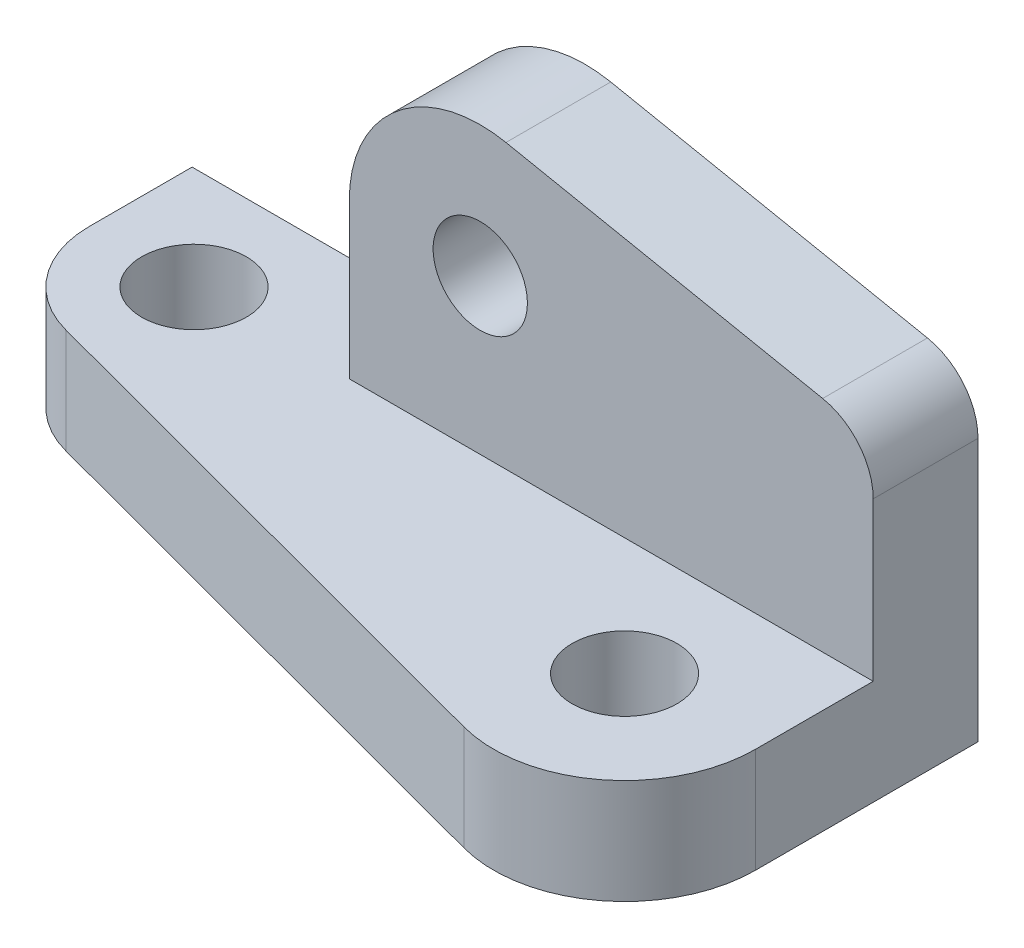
SolidWorks part; units mm, degrees
ref_plane "Front Plane" through (0, 0, 0) normal (0, 0, 1) x (1, 0, 0)
ref_plane "Top Plane" through (0, 0, 0) normal (0, 1, 0) x (1, 0, 0)
ref_plane "Right Plane" through (0, 0, 0) normal (1, 0, 0) x (0, 0, -1)
sketch "Sketch1" plane through (0, 0, 0) normal (0, 1, 0) x (1, 0, 0)
  line L1 (0, 0) -> (150, 0)
  line L2 (0, 0) -> (0, -35)
  line L3 (0, -35) -> (150, -75)
  line L4 (150, 0) -> (150, -75)
  dimension "D1" = 75
  dimension "D2" = 150
  dimension "D3" = 35
extrude "Boss-Extrude1" add sketch "Sketch1" along normal blind 20
sketch "Sketch2" plane through (0, 0, 0) normal (0, 0, -1) x (-1, 0, 0)
  line L1 (-50, 0) -> (-150, 0)
  line L2 (-50, 0) -> (-50, 80)
  line L3 (-50, 80) -> (-150, 60)
  line L4 (-150, 0) -> (-150, 60)
  dimension "D1" = 80
  dimension "D2" = 100
  dimension "D3" = 60
extrude "Boss-Extrude2" add sketch "Sketch2" against normal blind 20
fillet "Fillet1" radius 20 1 edges at (0, 10, 35)
fillet "Fillet2" radius 25 2 edges at (150, 10, 75) (50, 80, 10)
fillet "Fillet3" radius 12 1 edges at (150, 60, 10)
hole_wizard "Ø20.0 (20) Diameter Hole1" positions "Sketch6" profile "Sketch5" hole size "Ø20.0" standard "ANSI Metric"
sketch "Sketch6" plane through (0, 20, 0) normal (0, 1, 0) x (1, 0, 0)
  point P0 (20, -19.6344)
  point P3 (125, -42.4597)
sketch "Sketch5" plane through (20, 20, 19.6344) normal (1, 0, 0) x (0, 0, 1)
  line L0 (0, 0) -> (0, 20)
  line L1 (0, 20) -> (10, 20)
  line L2 (10, 20) -> (10, 0)
  line L5 (10, 0) -> (0, 0)
  line L11 (0, -6.35) -> (0, 107.95) construction
  dimension "Thru Hole Dia." = 20
  dimension "Thru Hole Depth" = 20
hole_wizard "Ø18.0 (18) Diameter Hole1" positions "Sketch8" profile "Sketch7" hole size "Ø18.0" standard "ANSI Metric"
sketch "Sketch8" plane through (0, 0, 20) normal (0, 0, 1) x (1, 0, 0)
  point P0 (75, 49.5049)
sketch "Sketch7" plane through (75, 49.5049, 20) normal (1, 0, 0) x (0, -1, 0)
  line L0 (0, 0) -> (0, 20)
  line L1 (0, 20) -> (9, 20)
  line L2 (9, 20) -> (9, 0)
  line L5 (9, 0) -> (0, 0)
  line L11 (0, -6.35) -> (0, 107.95) construction
  dimension "Thru Hole Dia." = 18
  dimension "Thru Hole Depth" = 20
